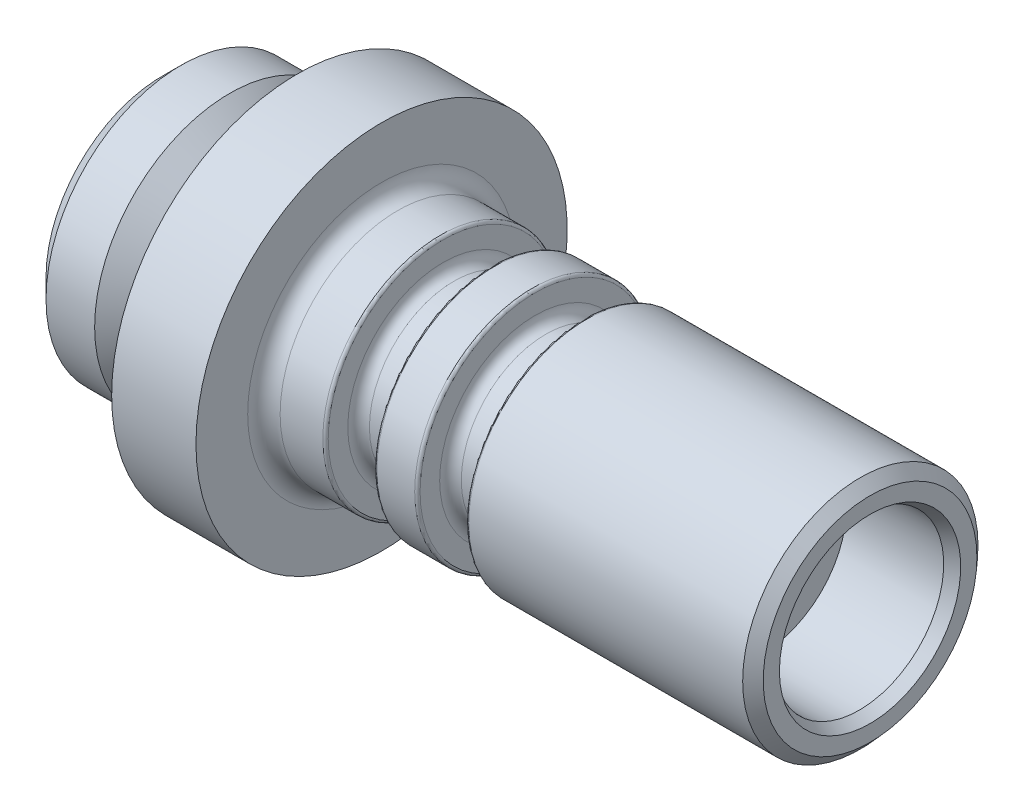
SolidWorks part; units mm, degrees
ref_plane "Front" through (0, 0, 0) normal (0, 0, 1) x (1, 0, 0)
ref_plane "Top" through (0, 0, 0) normal (0, 1, 0) x (1, 0, 0)
ref_plane "Right" through (0, 0, 0) normal (1, 0, 0) x (0, 0, -1)
sketch "Sketch1" plane through (0, 0, 0) normal (1, 0, 0) x (0, 0, -1)
  circle A0 centre (0, 0) radius 8.7249
  dimension "D1" = 17.4498
extrude "Base-Extrude" add sketch "Sketch1" along normal blind 33.274
sketch "Sketch2" plane through (0, 0, 0) normal (0, 0, 1) x (1, 0, 0)
  line L0 (0, 5.461) -> (0.889, 6.35)
  line L1 (0.889, 6.35) -> (3.175, 6.35)
  line L2 (3.175, 6.35) -> (4.064, 5.461)
  line L3 (4.064, 5.461) -> (6.35, 5.461)
  line L4 (6.35, 5.461) -> (6.35, 8.7249)
  line L5 (6.35, 8.7249) -> (0, 8.7249)
  line L6 (0, 8.7249) -> (0, 5.461)
  line L7 (0, 0) -> (14.9273, 0) construction
  line L8 (0, -55) -> (0, 55) construction
  line L9 (33.274, 8.7249) -> (0, 8.7249) construction
  dimension "D1" = 2.286
  dimension "D2" = 6.35
  dimension "D3" = 10.922
  dimension "D4" = 12.7
  dimension "D5" = 45
revolve "Cut-Revolve1" cut sketch "Sketch2" angle 360 about L7
sketch "Sketch3" plane through (0, 0, 0) normal (1, 0, 0) x (0, 0, -1)
  circle A0 centre (0, 0) radius 2.7051
  dimension "D1" = 5.4102
extrude "Cut-Extrude1" cut sketch "Sketch3" along normal through all
sketch "Sketch4" plane through (0, 0, 0) normal (0, 0, 1) x (1, 0, 0)
  line L0 (0, 0) -> (28.4329, 0) construction
  line L1 (33.274, -8.7249) -> (33.274, 8.7249) construction
  line L2 (10.3124, 8.7249) -> (33.274, 8.7249)
  line L3 (10.3124, 8.7249) -> (10.3124, 5.5308)
  line L4 (10.3124, 5.5308) -> (33.274, 5.5308)
  line L5 (33.274, 8.7249) -> (33.274, 5.5308)
  line L6 (33.274, 8.7249) -> (6.35, 8.7249) construction
  line L7 (6.35, 8.7249) -> (6.35, -8.7249) construction
  dimension "D1" = 3.9624
  dimension "D2" = 11.0617
revolve "Cut-Revolve2" cut sketch "Sketch4" angle 360 about L0
fillet "Fillet1" radius 0.762 2 edges at (10.3124, 0, 5.5308) (6.35, 0, 5.461)
sketch "Sketch5" plane through (0, 0, 0) normal (0, 0, 1) x (1, 0, 0)
  line L0 (0, 0) -> (28.3401, 0) construction
  line L1 (17.399, 5.5308) -> (19.939, 5.5309)
  line L2 (17.526, 5.4038) -> (17.526, 4.4831)
  line L3 (18.034, 3.9751) -> (19.304, 3.9751)
  line L4 (19.812, 4.4831) -> (19.812, 5.4039)
  line L5 (33.274, 5.5308) -> (11.0744, 5.5308) construction
  line L6 (33.274, -5.5308) -> (33.274, 5.5308) construction
  line L7 (13.081, 5.5308) -> (15.621, 5.5308)
  line L8 (13.208, 5.4038) -> (13.208, 4.4831)
  line L9 (13.716, 3.9751) -> (14.986, 3.9751)
  line L10 (15.494, 4.4831) -> (15.494, 5.4038)
  arc A0 (17.399, 5.5308) -> (17.526, 5.4038) centre (17.399, 5.4038) cw
  arc A1 (19.812, 5.4039) -> (19.939, 5.5309) centre (19.939, 5.4038) cw
  arc A2 (17.526, 4.4831) -> (18.034, 3.9751) centre (18.034, 4.4831) ccw
  arc A3 (19.304, 3.9751) -> (19.812, 4.4831) centre (19.304, 4.4831) ccw
  arc A4 (13.208, 4.4831) -> (13.716, 3.9751) centre (13.716, 4.4831) ccw
  arc A5 (14.986, 3.9751) -> (15.494, 4.4831) centre (14.986, 4.4831) ccw
  arc A6 (13.081, 5.5308) -> (13.208, 5.4038) centre (13.081, 5.4038) cw
  arc A7 (15.494, 5.4038) -> (15.621, 5.5308) centre (15.621, 5.4038) cw
  dimension "D1" = 0.127
  dimension "D2" = 0.508
  dimension "D6" = 2.032
  dimension "D3" = 13.462
  dimension "D4" = 2.286
  dimension "D5" = 7.9502
revolve "Cut-Revolve3" cut sketch "Sketch5" angle 360 about L0
chamfer "Chamfer1" distance 0.508 angle 42 1 edges at (33.274, 0, 5.5308)
sketch "Sketch6" plane through (0, 0, 0) normal (0, 0, 1) x (1, 0, 0)
  line L0 (23.7805, 0) -> (34.9222, 0) construction
  line L1 (33.274, 4.262) -> (32.766, 3.9688)
  line L2 (32.766, 3.9688) -> (28.194, 3.9687)
  line L3 (28.194, 3.9687) -> (28.194, 0)
  line L4 (28.194, 0) -> (33.274, 0)
  line L5 (33.274, 0) -> (33.274, 4.262)
  line L6 (33.274, -5.0228) -> (33.274, 5.0228) construction
  line L7 (9.5974, 0) -> (-9.5974, 0) construction
  dimension "D1" = 7.9375
  dimension "D2" = 0.508
  dimension "D3" = 30
  dimension "D4" = 5.08
revolve "Cut-Revolve4" cut sketch "Sketch6" angle 360 about L0
sketch "Sketch7" plane through (0, 0, 0) normal (0, 0, 1) x (1, 0, 0)
  line L0 (9.0572, 0) -> (-1.9714, 0) construction
  line L1 (0, 3.9751) -> (8.89, 3.9751)
  line L2 (8.89, 3.9751) -> (13.4628, 0)
  line L3 (13.4628, 0) -> (0, 0)
  line L4 (0, 0) -> (0, 3.9751)
  line L5 (0, -9.1611) -> (0, 9.1611) construction
  line L6 (9.1611, 0) -> (-9.1611, 0) construction
  line L7 (8.89, -3.9751) -> (13.4628, 0) construction
  dimension "D1" = 7.9502
  dimension "D2" = 82
  dimension "D3" = 8.89
revolve "Cut-Revolve5" cut sketch "Sketch7" angle 360 about L0
chamfer "Chamfer2" distance 0.508 angle 42 1 edges at (0, 0, -3.9751)
sketch "Sketch10" plane through (0, 0, 0) normal (0, 0, 1) x (1, 0, 0)
  line L0 (-2.3204, 0) -> (34.9939, 0) construction
  line L1 (33.274, 0) -> (32.766, 0) construction
